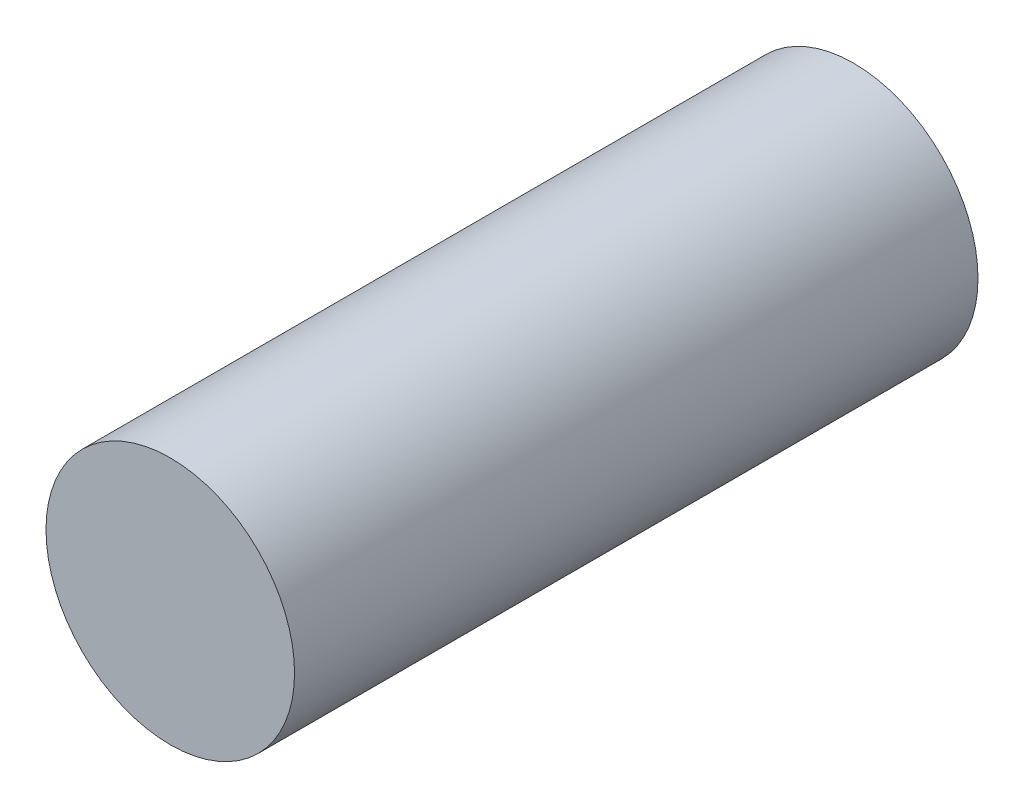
SolidWorks part; units mm, degrees
ref_plane "Frontal" through (0, 0, 0) normal (0, 0, 1) x (1, 0, 0)
ref_plane "Superior" through (0, 0, 0) normal (0, 1, 0) x (1, 0, 0)
ref_plane "Derecha" through (0, 0, 0) normal (1, 0, 0) x (0, 0, -1)
sketch "Croquis1" plane through (0, 0, 0) normal (0, 0, 1) x (1, 0, 0)
  circle A0 centre (0, 0) radius 4
  dimension "D1" = 8
extrude "Extruir1" add sketch "Croquis1" along normal blind 22
